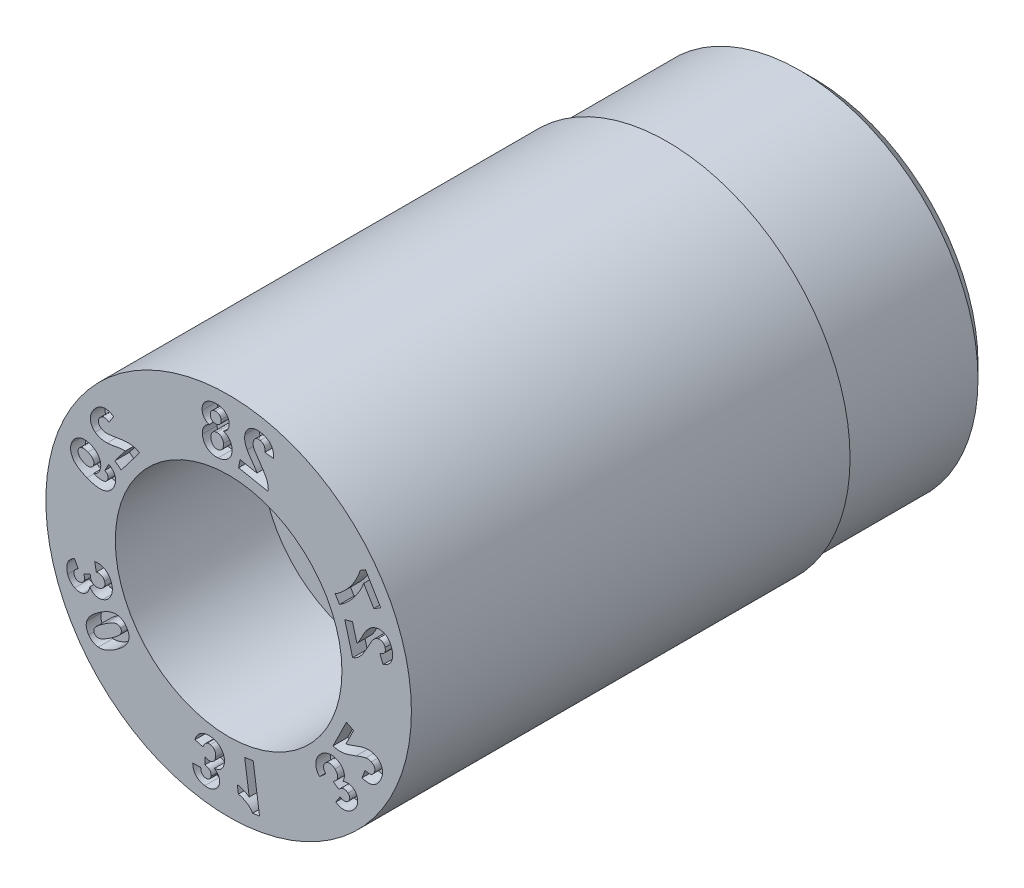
SolidWorks part; units mm, degrees
ref_plane "Front Plane" through (0, 0, 0) normal (0, 0, 1) x (1, 0, 0)
ref_plane "Top Plane" through (0, 0, 0) normal (0, 1, 0) x (1, 0, 0)
ref_plane "Right Plane" through (0, 0, 0) normal (1, 0, 0) x (0, 0, -1)
sketch "Sketch1" plane through (0, 0, 0) normal (1, 0, 0) x (0, 0, -1)
  line L2 (0, 2.5) -> (0, 1.55)
  line L3 (7.75, 2.5) -> (0, 2.5)
  line L4 (-3.7979, 0) -> (49996.2021, 0) construction
  line L8 (8, 0.8) -> (2, 0.8)
  line L9 (2, 1.55) -> (2, 0.8)
  line L10 (2, 1.55) -> (0, 1.55)
  line L12 (8, 0.8) -> (8, 2.25)
  line L16 (8, 2.25) -> (7.75, 2.5)
  dimension "D1" = 8
  dimension "D2" = 45
  dimension "D3" = 0.25
  dimension "D4" = 5
  dimension "D5" = 3.1
  dimension "D6" = 2
  dimension "D7" = 1.6
revolve "Revolve1" add sketch "Sketch1" angle 360 about L4
sketch "Sketch4" plane through (0, 0, 0) normal (1, 0, 0) x (0, 0, -1)
  line L0 (0, 0) -> (50000, 0) construction
  line L1 (8, -2.25) -> (8, 2.25) construction
  line L2 (6, 3.435) -> (8, 3.435)
  line L3 (6, 3.435) -> (6, 2.435)
  line L4 (6, 2.435) -> (8, 2.435)
  line L5 (8, 3.435) -> (8, 2.435)
  line L6 (7.75, 2.5) -> (0, 2.5) construction
  line L7 (0, 2.5) -> (0, -2.5) construction
  dimension "D1" = 1
  dimension "D2" = 0.065
  dimension "D3" = 6
revolve "Cut-Revolve1" cut sketch "Sketch4" angle 360 about L0
sketch "Sketch6" plane through (0, 0, 0) normal (0, 0, 1) x (1, 0, 0)
  arc A0 (1.7016, 0.2135) -> (1.7127, -0.0874) centre (0, 0) ccw construction
  text T0 "27    28    29   30    31   32" font "Arial" height 0.62
  dimension "D1" = 1.715
extrude "Cut-Extrude1" cut sketch "Sketch6" against normal blind 0.2
